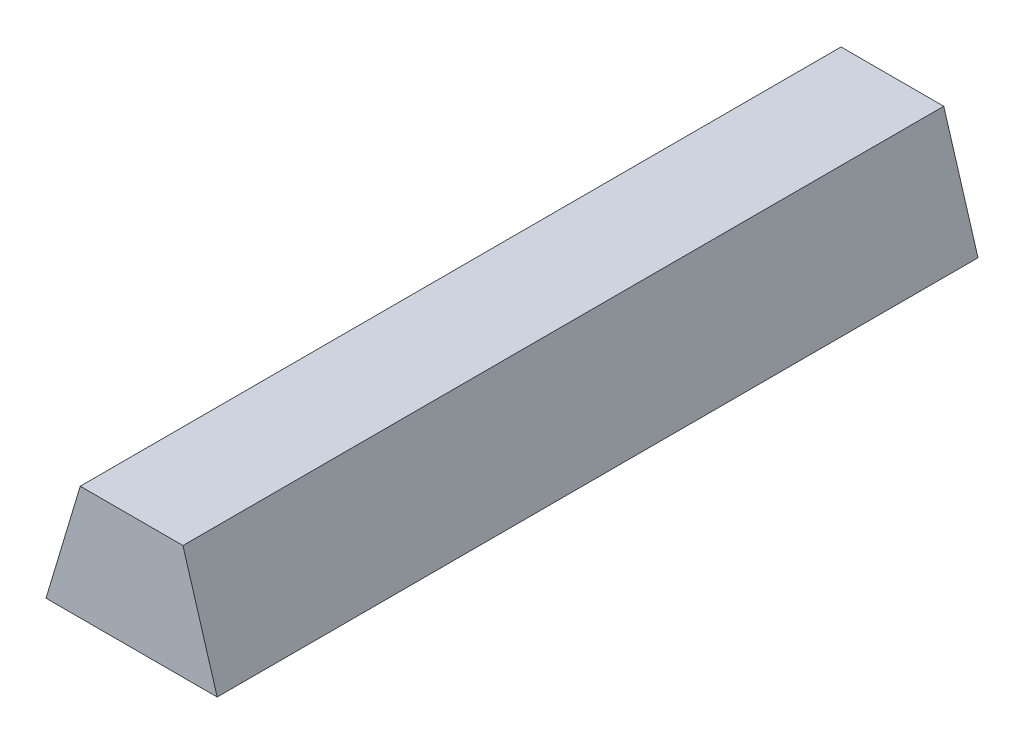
SolidWorks part; units mm, degrees
ref_plane "前视基准面" through (0, 0, 0) normal (0, 0, 1) x (1, 0, 0)
ref_plane "上视基准面" through (0, 0, 0) normal (0, 1, 0) x (1, 0, 0)
ref_plane "右视基准面" through (0, 0, 0) normal (1, 0, 0) x (0, 0, -1)
sketch "草图1" plane through (0, 0, 0) normal (0, 0, 1) x (1, 0, 0)
  line L0 (-135, 150) -> (135, 150)
  line L1 (-225, 150) -> (225, 150)
  line L2 (-225, 150) -> (-225, -150)
  line L3 (-225, -150) -> (225, -150)
  line L4 (225, 150) -> (225, -150)
  line L5 (-225, 150) -> (225, -150) construction
  line L6 (-225, -150) -> (225, 150) construction
  line L7 (-135, 150) -> (-225, -150)
  line L8 (135, 150) -> (225, -150)
  point P0 (0, 0)
  point P9 (0, 150)
  dimension "D1" = 450
  dimension "D2" = 300
  dimension "D3" = 270
extrude "凸台-拉伸1" add sketch "草图1" along normal blind 2000 contours L8 L0 L7 L3
